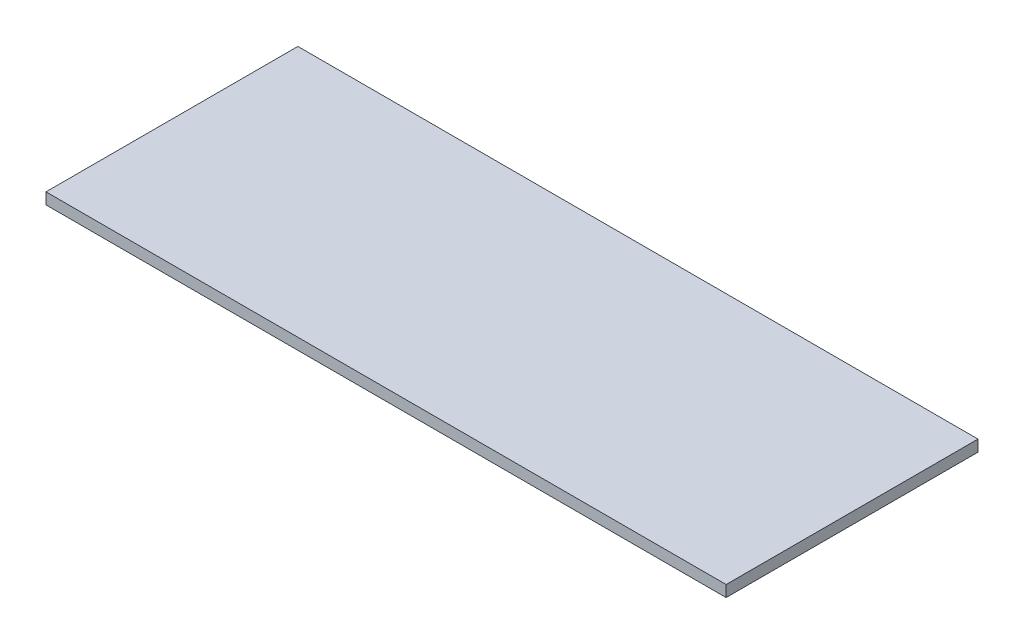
SolidWorks part; units mm, degrees
ref_plane "Front Plane" through (0, 0, 0) normal (0, 0, 1) x (1, 0, 0)
ref_plane "Top Plane" through (0, 0, 0) normal (0, 1, 0) x (1, 0, 0)
ref_plane "Right Plane" through (0, 0, 0) normal (1, 0, 0) x (0, 0, -1)
sketch "Sketch1" plane through (0, 0, 0) normal (0, 1, 0) x (1, 0, 0)
  line L1 (-76.2, 28.2194) -> (76.2, 28.2194)
  line L2 (-76.2, 28.2194) -> (-76.2, -28.2194)
  line L3 (-76.2, -28.2194) -> (76.2, -28.2194)
  line L4 (76.2, 28.2194) -> (76.2, -28.2194)
  line L5 (-76.2, 28.2194) -> (76.2, -28.2194) construction
  line L6 (-76.2, -28.2194) -> (76.2, 28.2194) construction
  point P0 (0, 0)
  dimension "D1" = 56.4388
  dimension "D2" = 152.4
extrude "Boss-Extrude1" add sketch "Sketch1" along normal blind 2.54
equation "\"thickness_acrylic0.1\"=0.1in"
equation "\"motor offset\"=6mm"
equation "\"thickness0.25\"=0.225in"
equation "\"thickness0.125\"=0.122in"
